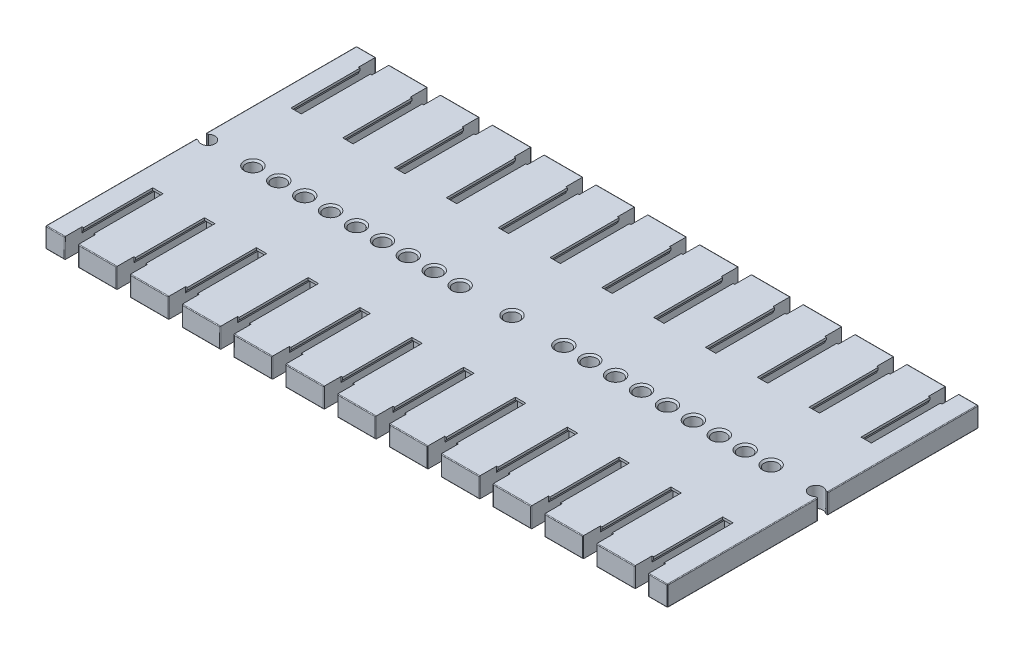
SolidWorks part; units mm, degrees
ref_plane "前视基准面" through (0, 0, 0) normal (0, 0, 1) x (1, 0, 0)
ref_plane "上视基准面" through (0, 0, 0) normal (0, 1, 0) x (1, 0, 0)
ref_plane "右视基准面" through (0, 0, 0) normal (1, 0, 0) x (0, 0, -1)
sketch "草图1" plane through (0, 0, 0) normal (0, 1, 0) x (1, 0, 0)
  line L0 (90, 45) -> (90, -45)
  line L1 (90, 45) -> (-90, 45)
  line L2 (90, -45) -> (-90, -45)
  line L3 (-90, 45) -> (-90, -45)
  line L4 (90, 45) -> (-90, -45) construction
  line L5 (90, -45) -> (-90, 45) construction
  point P1 (0, 0)
  dimension "D1" = 90
  dimension "D2" = 180
extrude "凸台-拉伸1" add sketch "草图1" along normal blind 5.8
sketch "草图2" plane through (0, 0, 45) normal (0, 0, 1) x (1, 0, 0)
  line L0 (-90, 2.9) -> (-82.5, 2.9) construction
  line L1 (-90, 5.8) -> (-90, 0) construction
  line L2 (-82.5, 2.9) -> (-82.5, 5.8) construction
  line L3 (-90, 5.8) -> (90, 5.8) construction
  line L4 (-82.5, 5.8) -> (-82.5, 3.8) construction
  line L5 (-81, 5.8) -> (-84, 5.8)
  line L6 (-84, 5.8) -> (-84, 5.1229)
  line L7 (-82.5, 2.9) -> (-80.55, 2.9) construction
  line L8 (-80.55, 1.5556) -> (-80.55, 4.2444)
  line L9 (-81, 5.8) -> (-81, 5.1229)
  line L10 (-81, 0) -> (-81, 0.6771)
  line L11 (-81, 0) -> (-84, 0)
  line L12 (-84, 0) -> (-84, 0.6771)
  line L13 (-84.45, 1.5556) -> (-84.45, 4.2444)
  arc A0 (-84, 5.1229) -> (-84.45, 4.2444) centre (-82.5, 3.8) ccw
  arc A1 (-80.55, 1.5556) -> (-81, 0.6771) centre (-82.5, 2) cw
  arc A2 (-80.55, 4.2444) -> (-81, 5.1229) centre (-82.5, 3.8) ccw
  arc A3 (-84, 0.6771) -> (-84.45, 1.5556) centre (-82.5, 2) cw
  dimension "D4" = 2
  dimension "D1" = 7.5
  dimension "D2" = 2
  dimension "D3" = 1.5
  dimension "D5" = 1.95
extrude "切除-拉伸1" cut sketch "草图2" against normal blind 26
sketch "草图3" plane through (0, 0, 19) normal (0, 0, 1) x (1, 0, 0)
  line L0 (-84, 5.8) -> (-84, 5.1229)
  line L1 (-84, 5.1229) -> (-81, 5.1229)
  line L2 (-81, 5.1229) -> (-81, 5.8)
  line L3 (-81, 5.8) -> (-84, 5.8)
  line L4 (-84, 0.6771) -> (-84, 0)
  line L5 (-84, 0) -> (-81, 0)
  line L6 (-81, 0) -> (-81, 0.6771)
  line L7 (-81, 0.6771) -> (-84, 0.6771)
extrude "凸台-拉伸2" add sketch "草图3" along normal blind 1
sketch "草图4" plane through (0, 0, 45) normal (0, 0, 1) x (1, 0, 0)
  line L0 (-90, 2.9) -> (-82.5, 2.9) construction
  line L1 (-90, 5.8) -> (-90, 0) construction
  line L2 (-80.55, 5.8) -> (-80.55, 0)
  line L3 (-80.55, 5.8) -> (-84.45, 5.8)
  line L4 (-80.55, 0) -> (-84.45, 0)
  line L5 (-84.45, 5.8) -> (-84.45, 0)
  line L6 (-80.55, 5.8) -> (-84.45, 0) construction
  line L7 (-80.55, 0) -> (-84.45, 5.8) construction
  dimension "D1" = 7.5
  dimension "D2" = 3.9
  dimension "D3" = 5.8
extrude "切除-拉伸2" cut sketch "草图4" against normal blind 5
mirror "镜向4" about plane through (0, 0, 0) normal (0, 0, 1) of "切除-拉伸2", "凸台-拉伸2", "切除-拉伸1"
pattern_linear "阵列(线性)4" count 12 spacing 15 along (1, 0, 0) of "镜向4", "切除-拉伸1", "凸台-拉伸2", "切除-拉伸2"
sketch "草图6" plane through (0, 0, 0) normal (0, -1, 0) x (1, 0, 0)
  line L0 (-90, 0) -> (-75, 0) construction
  line L1 (-90, -45) -> (-90, 45) construction
  circle A0 centre (-75, 0) radius 2
  dimension "D3" = 4
  dimension "D1" = 15
extrude "切除-拉伸3" cut sketch "草图6" against normal up to next
chamfer "倒角1" distance 0.5 angle 45 2 edges at (-75, 5.8, 2) (-75, 0, -2)
pattern_linear "阵列(线性)5" count 11 spacing 15 along (1, 0, 0) of "切除-拉伸3", "倒角1"
sketch "草图7" plane through (0, 0, 0) normal (0, -1, 0) x (1, 0, 0)
  line L0 (-90, 0) -> (-67.5, 0) construction
  line L1 (-90, -45) -> (-90, 45) construction
  circle A0 centre (-67.5, 0) radius 2
  dimension "D2" = 4
  dimension "D1" = 22.5
extrude "切除-拉伸4" cut sketch "草图7" against normal up to next
chamfer "倒角2" distance 0.5 angle 45 2 edges at (-67.5, 5.8, 2) (-67.5, 0, -2)
pattern_linear "阵列(线性)7" count 4 spacing 15 along (1, 0, 0) of "倒角2", "切除-拉伸4"
mirror "镜向5" about plane through (0, 0, 0) normal (1, 0, 0) of "阵列(线性)7", "切除-拉伸4", "倒角2"
sketch "草图8" plane through (0, 0, 0) normal (0, -1, 0) x (1, 0, 0)
  line L0 (-90, 0) -> (-88, 0) construction
  line L1 (-90, -45) -> (-90, 45) construction
  line L2 (-90, -1.5) -> (-90, 1.5)
  line L3 (-90, 1.5) -> (-89.3229, 1.5)
  line L4 (-90, -1.5) -> (-89.3229, -1.5)
  arc A0 (-89.3229, -1.5) -> (-89.3229, 1.5) centre (-88, 0) ccw
  dimension "D3" = 2
  dimension "D1" = 2
  dimension "D2" = 1.5
extrude "切除-拉伸5" cut sketch "草图8" against normal up to next
mirror "镜向6" about plane through (0, 0, 0) normal (1, 0, 0) of "切除-拉伸5"
fillet "圆角4" radius 0.2 116 edges at (-87.225, 5.8, 45) (-84.45, 2.9, 45) (-87.225, 0, 45) (-80.55, 2.9, 45) (-75, 5.8, 45) (-54.45, 2.9, 45) (-65.55, 2.9, 45) (-39.45, 2.9, 45) (-50.55, 2.9, 45) (-24.45, 2.9, 45) (-35.55, 2.9, 45) (-9.45, 2.9, 45) (-20.55, 2.9, 45) (5.55, 2.9, 45) (-5.55, 2.9, 45) (20.55, 2.9, 45) (9.45, 2.9, 45) (35.55, 2.9, 45) (24.45, 2.9, 45) (50.55, 2.9, 45) (39.45, 2.9, 45) (65.55, 2.9, 45) (54.45, 2.9, 45) (80.55, 2.9, 45) (69.45, 2.9, 45) (84.45, 2.9, 45) (90, 2.9, 45) (-69.45, 2.9, 45) (-90, 2.9, 45) (-75, 0, 45) (-60, 5.8, 45) (-45, 5.8, 45) (-30, 5.8, 45) (-15, 5.8, 45) (0, 5.8, 45) (15, 5.8, 45) (30, 5.8, 45) (45, 5.8, 45) (60, 5.8, 45) (75, 5.8, 45) (87.225, 5.8, 45) (87.225, 0, 45) (75, 0, 45) (60, 0, 45) (45, 0, 45) (30, 0, 45) (15, 0, 45) (0, 0, 45) (-15, 0, 45) (-30, 0, 45) (-45, 0, 45) (-60, 0, 45) (90, 0, 23.25) (90, 5.8, 23.25) (90, 2.9, 1.5) (90, 5.8, -23.25) (90, 0, -23.25) (90, 2.9, -1.5) (87.225, 0, -45) (90, 2.9, -45) (87.225, 5.8, -45) (35.55, 2.9, -45) (24.45, 2.9, -45) (50.55, 2.9, -45) (39.45, 2.9, -45) (65.55, 2.9, -45) (54.45, 2.9, -45) (80.55, 2.9, -45) (69.45, 2.9, -45) (84.45, 2.9, -45) (-84.45, 2.9, -45) (-90, 2.9, -45) (-69.45, 2.9, -45) (-80.55, 2.9, -45) (-54.45, 2.9, -45) (-65.55, 2.9, -45) (-39.45, 2.9, -45) (-50.55, 2.9, -45) (-24.45, 2.9, -45) (-35.55, 2.9, -45) (-9.45, 2.9, -45) (-20.55, 2.9, -45) (5.55, 2.9, -45) (-5.55, 2.9, -45) (20.55, 2.9, -45) (9.45, 2.9, -45) (75, 5.8, -45) (60, 5.8, -45) (45, 5.8, -45) (30, 5.8, -45) (15, 5.8, -45) (0, 5.8, -45) (-15, 5.8, -45) (-30, 5.8, -45) (-45, 5.8, -45) (-60, 5.8, -45) (-75, 5.8, -45) (-87.225, 5.8, -45) (-87.225, 0, -45) (-75, 0, -45) (-60, 0, -45) (-45, 0, -45) (-30, 0, -45) (-15, 0, -45) (0, 0, -45) (15, 0, -45) (30, 0, -45) (45, 0, -45) (60, 0, -45) (75, 0, -45) (-90, 5.8, -23.25) (-90, 2.9, -1.5) (-90, 0, -23.25) (-90, 0, 23.25) (-90, 2.9, 1.5) (-90, 5.8, 23.25)
